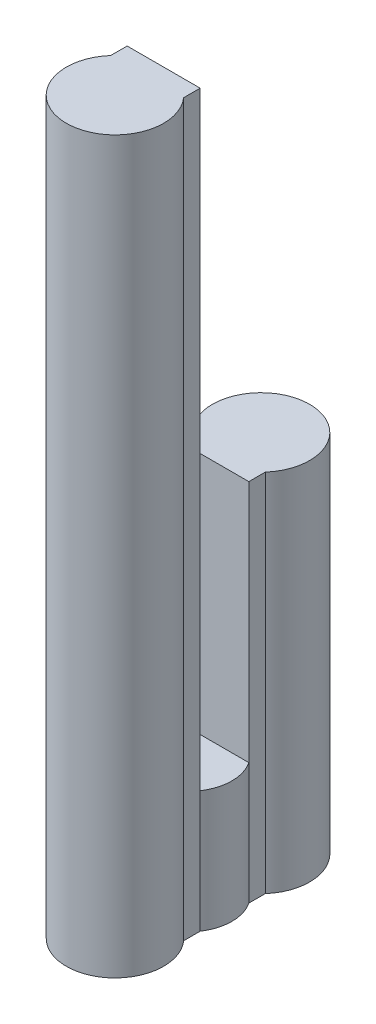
SolidWorks part; units mm, degrees
ref_plane "前视基准面" through (0, 0, 0) normal (0, 0, 1) x (1, 0, 0)
ref_plane "上视基准面" through (0, 0, 0) normal (0, 1, 0) x (1, 0, 0)
ref_plane "右视基准面" through (0, 0, 0) normal (1, 0, 0) x (0, 0, -1)
sketch "草图1" plane through (0, 0, 0) normal (0, 1, 0) x (1, 0, 0)
  line L0 (0, 0) -> (0, 2) construction
  line L1 (-1.5, 0) -> (1.5, 0)
  line L2 (1.5, 0) -> (1.5, 0.6771)
  line L3 (-1.5, 0) -> (-1.5, 0.6771)
  arc A0 (1.5, 0.6771) -> (-1.5, 0.6771) centre (0, 2) ccw
  dimension "D1" = 2
  dimension "D2" = 1.5
extrude "凸台-拉伸1" add sketch "草图1" along normal blind 15
sketch "草图2" plane through (0, 0, 0) normal (0, -1, 0) x (1, 0, 0)
  line L0 (0, 0) -> (0, 2) construction
  line L1 (-1.5, 0) -> (1.5, 0) construction
  line L2 (0, 2) -> (0, 4) construction
  line L3 (1.5, 2) -> (-1.5, 2)
  line L4 (-1.5, 2) -> (-1.5, 2.6771)
  line L5 (1.5, 2) -> (1.5, 2.6771)
  arc A0 (1.5, 2.6771) -> (-1.5, 2.6771) centre (0, 4) ccw
  dimension "D1" = 2
  dimension "D2" = 2
  dimension "D3" = 1.5
extrude "凸台-拉伸2" add sketch "草图2" against normal blind 30 separate body
sketch "草图3" plane through (0, 0, 0) normal (0, -1, 0) x (1, 0, 0)
  circle A0 centre (0, 1) radius 1.8028
extrude "凸台-拉伸3" add sketch "草图3" against normal blind 5
